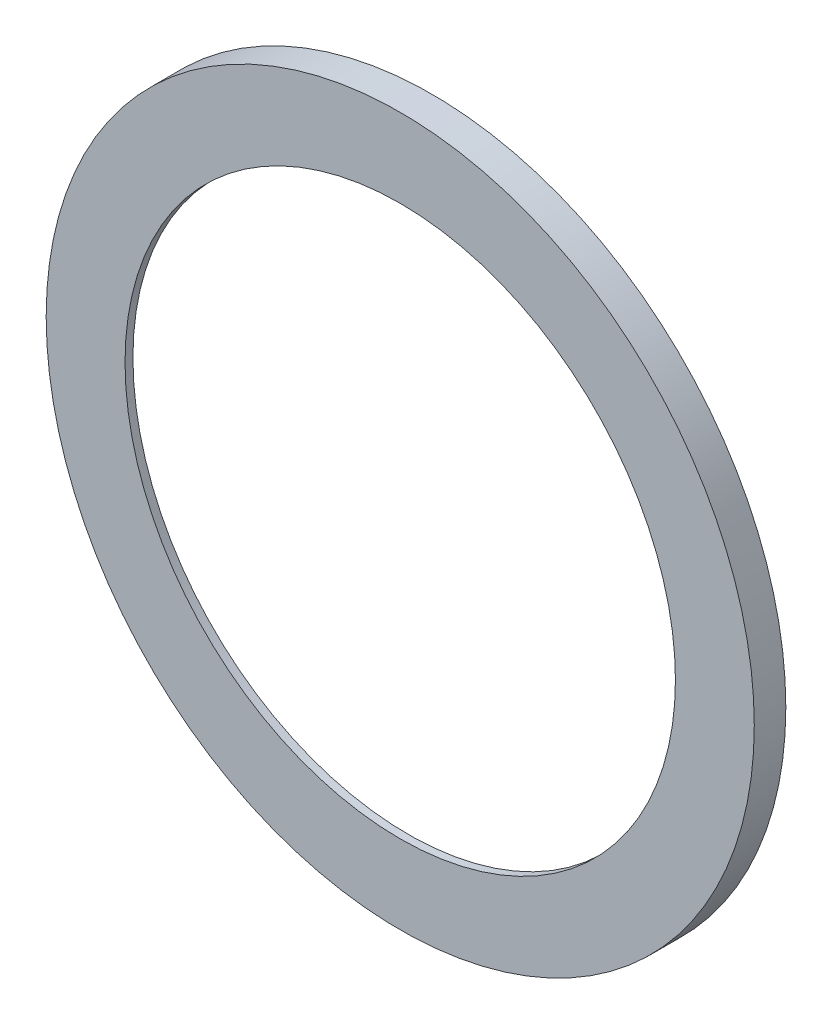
SolidWorks part; units mm, degrees
ref_plane "Front Plane" through (0, 0, 0) normal (0, 0, 1) x (1, 0, 0)
ref_plane "Top Plane" through (0, 0, 0) normal (0, 1, 0) x (1, 0, 0)
ref_plane "Right Plane" through (0, 0, 0) normal (1, 0, 0) x (0, 0, -1)
sketch "Sketch1" plane through (0, 0, 0) normal (0, 0, 1) x (1, 0, 0)
  circle A0 centre (0, 0) radius 174.5
  circle A1 centre (0, 0) radius 224.5
  dimension "D1" = 449
  dimension "D2" = 349
extrude "Extrude1" add sketch "Sketch1" along normal blind 20
sketch "Sketch2" plane through (0, 0, 0) normal (0, 0, -1) x (-1, 0, 0)
  circle A0 centre (0, 0) radius 222
  circle A2 centre (0, 0) radius 174.5 construction
  circle A3 centre (0, 0) radius 174.5
  dimension "D1" = 444
extrude "Cut-Extrude1" cut sketch "Sketch2" against normal blind 15
